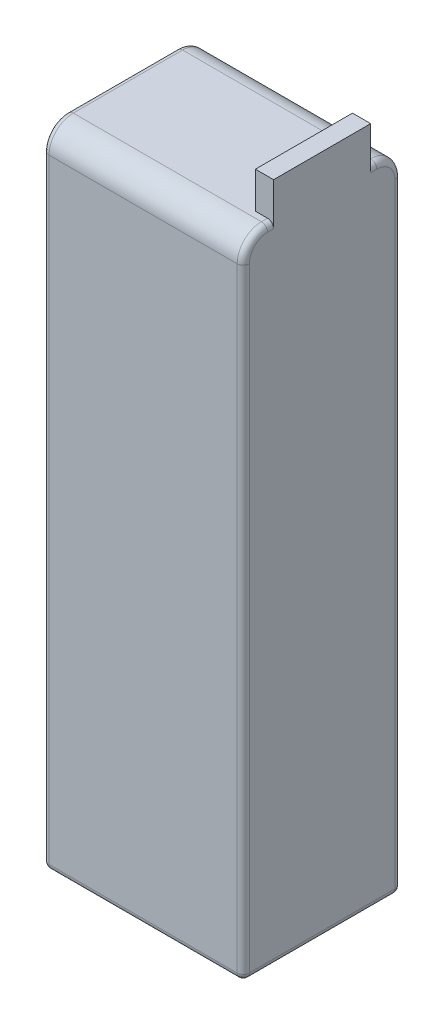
SolidWorks part; units mm, degrees
ref_plane "Front Plane" through (0, 0, 0) normal (0, 0, 1) x (1, 0, 0)
ref_plane "Top Plane" through (0, 0, 0) normal (0, 1, 0) x (1, 0, 0)
ref_plane "Right Plane" through (0, 0, 0) normal (1, 0, 0) x (0, 0, -1)
sketch "Sketch1" plane through (0, 0, 0) normal (0, 1, 0) x (1, 0, 0)
  line L1 (-20.955, -16.51) -> (20.955, -16.51)
  line L2 (-20.955, -16.51) -> (-20.955, 16.51)
  line L3 (-20.955, 16.51) -> (20.955, 16.51)
  line L4 (20.955, -16.51) -> (20.955, 16.51)
  line L5 (-20.955, -16.51) -> (20.955, 16.51) construction
  line L6 (-20.955, 16.51) -> (20.955, -16.51) construction
  point P0 (0, 0)
  dimension "D1" = 41.91
  dimension "D2" = 33.02
extrude "Boss-Extrude1" add sketch "Sketch1" along normal mid plane 134.874
sketch "Sketch2" plane through (0, 67.437, 0) normal (0, 1, 0) x (1, 0, 0)
  line L0 (20.955, -16.51) -> (20.955, 16.51) construction
  line L1 (20.955, 10.16) -> (17.145, 10.16)
  line L2 (20.955, 10.16) -> (20.955, -10.16)
  line L3 (20.955, -10.16) -> (17.145, -10.16)
  line L4 (17.145, 10.16) -> (17.145, -10.16)
  point P6 (17.145, 0)
  dimension "D1" = 20.32
  dimension "D2" = 3.81
extrude "Boss-Extrude2" add sketch "Sketch2" along normal blind 7.62
fillet "Fillet1" radius 5.08 2 edges at (0, 67.437, -16.51) (0, 67.437, 16.51)
fillet "Fillet2" radius 1.27 15 edges at (20.955, 67.437, -10.795) (20.955, 65.9491, -15.0221) (-20.955, 65.9491, -15.0221) (-20.955, 67.437, 0) (-20.955, 65.9491, 15.0221) (20.955, 67.437, 10.795) (20.955, 65.9491, 15.0221) (0, -67.437, -16.51) (20.955, -2.54, -16.51) (-20.955, -2.54, -16.51) (0, -67.437, 16.51) (-20.955, -2.54, 16.51) (20.955, -2.54, 16.51) (-20.955, -67.437, 0) (20.955, -67.437, 0)
